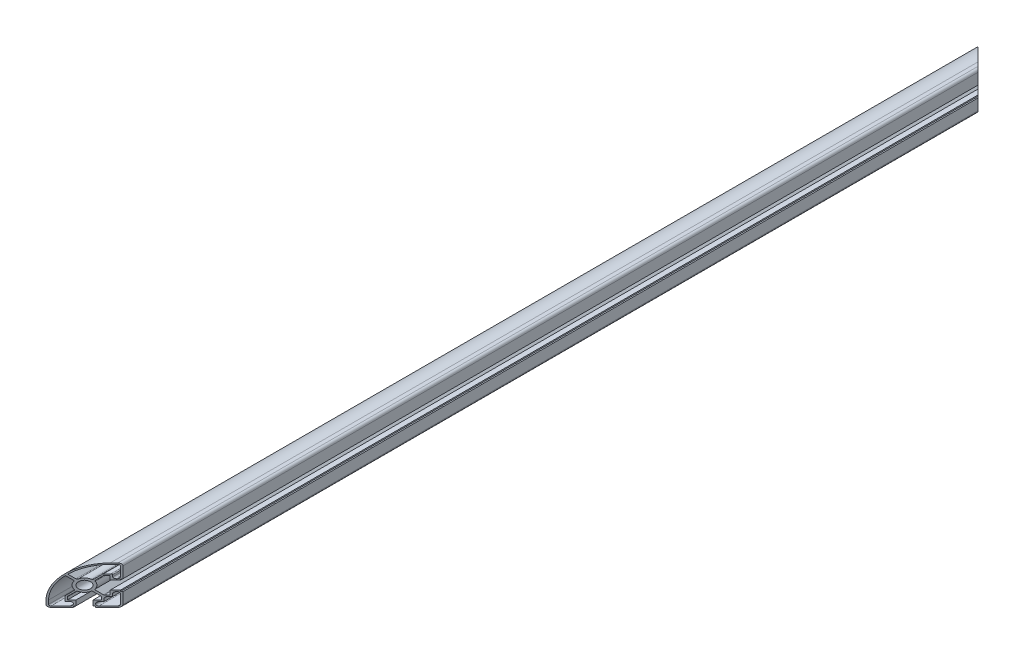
SolidWorks part; units mm, degrees
ref_plane "Ebene vorne" through (0, 0, 0) normal (0, 0, 1) x (1, 0, 0)
ref_plane "Ebene oben" through (0, 0, 0) normal (0, 1, 0) x (1, 0, 0)
ref_plane "Ebene rechts" through (0, 0, 0) normal (1, 0, 0) x (0, 0, -1)
sketch "Skizze1" plane through (0, 0, 0) normal (0, 0, 1) x (1, 0, 0)
  line L0 (-3, 0) -> (-16, 0)
  line L1 (0, 3) -> (0, 16)
  line L2 (-3, 45) -> (-7.5, 45)
  line L3 (-45, 3) -> (-45, 7.5)
  line L4 (-27.5, 1.5) -> (-27.5, 7.5)
  line L5 (-32.5, 7.5) -> (-32.5, 10.6716)
  line L6 (-32.5, 7.5) -> (-27.5, 7.5)
  line L7 (-27.5018, 16.084) -> (-32.2071, 11.3787)
  line L8 (0, 0) -> (-41.2602, 41.2602) construction
  line L9 (-22.5, -8.66) -> (-22.5, 55.2654) construction
  line L10 (-12.5, 7.5) -> (-12.5, 10.6716)
  line L11 (-17.5, 1.5) -> (-17.5, 7.5)
  line L12 (-12.5, 7.5) -> (-17.5, 7.5)
  line L13 (-18.0813, 16.6671) -> (-12.7929, 11.3787)
  line L14 (0.7071, 0.7071) -> (-0.2929, 1.7071)
  line L15 (-0.7071, -0.7071) -> (-1.7071, 0.2929)
  line L16 (0.7071, 0.7071) -> (-40.5531, 41.9673) construction
  line L17 (-0.7071, -0.7071) -> (-41.9673, 40.5531) construction
  line L18 (-28.916, 27.5018) -> (-33.6531, 32.2389)
  line L19 (-27.5018, 28.916) -> (-32.2389, 33.6531)
  line L20 (0, 16) -> (-6, 16) construction
  line L21 (-16.6671, 18.0813) -> (-11.3787, 12.7929)
  line L22 (-7.5, 12.5) -> (-10.6716, 12.5)
  line L23 (-7.5, 12.5) -> (-7.5, 17.5)
  line L24 (-1.5, 17.5) -> (-7.5, 17.5)
  line L25 (-1.5, 27.5) -> (-7.5, 27.5)
  line L26 (-7.5, 32.5) -> (-7.5, 27.5)
  line L27 (-7.5, 32.5) -> (-10.6716, 32.5)
  line L28 (-16.084, 27.5018) -> (-11.3787, 32.2071)
  line L29 (-17.0207, 17.7278) -> (-16.9842, 17.6913)
  line L30 (-11, 6) -> (-11, 9)
  line L31 (-11, 6) -> (-14, 6)
  line L32 (-16, 3.5) -> (-16, 4)
  line L33 (-3.5, 16) -> (-4, 16)
  line L34 (-6, 11) -> (-6, 14)
  line L35 (-6, 11) -> (-9, 11)
  line L36 (-17.7278, 17.0207) -> (-17.6913, 16.9842)
  line L37 (-3, 1.5) -> (-14, 1.5)
  line L38 (-43.5, 3) -> (-43.5, 7.5)
  line L39 (-3, 43.5) -> (-7.5, 43.5)
  line L40 (-1.5, 3) -> (-1.5, 14)
  line L41 (-11, 6) -> (-11, 11.7071) construction
  line L42 (-6, 11) -> (-11.7071, 11) construction
  line L43 (-17.0207, 17.7278) -> (-11, 11.7071) construction
  line L44 (-17.7278, 17.0207) -> (-11.7071, 11) construction
  line L45 (0, 17.5) -> (-7.5, 17.5) construction
  line L46 (-16, 0) -> (-16, 6) construction
  line L47 (-17.5, 0) -> (-17.5, 7.5) construction
  line L48 (-11, 6) -> (-16, 6) construction
  line L49 (-3, 1.5) -> (-42, 1.5) construction
  line L50 (-1.5, 3) -> (-1.5, 42) construction
  line L51 (-6, 11) -> (-6, 16) construction
  line L52 (0, 27.5) -> (-7.5, 27.5) construction
  line L55 (-42, 1.5) -> (-31, 1.5)
  line L56 (-1.5, 42) -> (-1.5, 31)
  line L57 (-3.5, 29) -> (-4, 29)
  line L58 (-6, 33) -> (-6, 31)
  line L59 (-7, 34) -> (-11.2929, 34)
  line L60 (-17.0686, 28.6385) -> (-12, 33.7071)
  line L61 (-28.6385, 17.0686) -> (-34, 11.7071)
  line L62 (-34, 6) -> (-34, 11.7071)
  line L63 (-34, 6) -> (-31, 6)
  line L64 (-29, 3.5) -> (-29, 4)
  line L65 (0, 29) -> (-6, 29) construction
  line L66 (-17.7278, 27.9793) -> (-11.7071, 34) construction
  line L67 (-16.6671, 26.9187) -> (-11.0858, 32.5) construction
  line L68 (-26.9187, 16.6671) -> (-32.5, 11.0858) construction
  line L69 (-27.9793, 17.7278) -> (-34, 11.7071) construction
  line L70 (-29, 1.5) -> (-29, 6) construction
  line L71 (-34, 6) -> (-29, 6) construction
  line L72 (-6, 34) -> (-6, 29) construction
  line L73 (-6, 34) -> (-11.7071, 34) construction
  line L74 (-7.5, 32.5) -> (-11.0858, 32.5) construction
  line L75 (-32.5, 7.5) -> (-32.5, 11.0858) construction
  line L76 (-12.5, 7.5) -> (-12.5, 11.0858) construction
  line L77 (-18.0813, 16.6671) -> (-12.5, 11.0858) construction
  line L78 (-7.5, 12.5) -> (-11.0858, 12.5) construction
  line L79 (-16.6671, 18.0813) -> (-11.0858, 12.5) construction
  line L80 (0, 29) -> (0, 42)
  line L81 (0, 3) -> (0, 42) construction
  line L82 (-29, 0) -> (-42, 0)
  line L83 (-3, 0) -> (-42, 0) construction
  line L84 (-1.5, 17.5) -> (-1.5, 16)
  line L85 (-27.5, 1.5) -> (-29, 1.5)
  line L86 (-1.5, 16) -> (0, 16)
  line L88 (-29, 1.5) -> (-29, 0)
  line L89 (-17.5, 1.5) -> (-16, 1.5)
  line L92 (-16, 1.5) -> (-16, 0)
  line L95 (0, 29) -> (-1.5, 29)
  line L96 (-1.5, 27.5) -> (-1.5, 29)
  arc A0 (-7.5, 45) -> (-45, 7.5) centre (-7.5, 7.5) ccw
  circle A1 centre (-22.5, 22.5) radius 5
  arc A2 (-45, 3) -> (-42, 0) centre (-42, 3) ccw
  arc A3 (0, 42) -> (-3, 45) centre (-3, 42) ccw
  arc A4 (0, 3) -> (-3, 0) centre (-3, 3) cw
  arc A5 (-28.7667, 26.2783) -> (-28.5226, 18.3437) centre (-22.5, 22.5) ccw
  arc A6 (-43.5, 3) -> (-42, 1.5) centre (-42, 3) ccw
  arc A7 (-7.5, 43.5) -> (-32.2389, 33.6531) centre (-7.5, 7.5) ccw
  arc A8 (-1.5, 42) -> (-3, 43.5) centre (-3, 42) ccw
  arc A9 (-1.5, 3) -> (-3, 1.5) centre (-3, 3) cw
  arc A10 (-9, 11) -> (-11, 9) centre (-9, 9) ccw
  arc A11 (-16, 4) -> (-14, 6) centre (-14, 4) cw
  arc A12 (-14, 1.5) -> (-16, 3.5) centre (-14, 3.5) cw
  arc A13 (-1.5, 14) -> (-3.5, 16) centre (-3.5, 14) ccw
  arc A14 (-6, 14) -> (-4, 16) centre (-4, 14) cw
  arc A15 (-33.6531, 32.2389) -> (-43.5, 7.5) centre (-7.5, 7.5) ccw
  arc A16 (-7.5, 43.5) -> (-43.5, 7.5) centre (-7.5, 7.5) ccw construction
  arc A17 (-26.2783, 16.2333) -> (-16.2333, 26.2783) centre (-22.5, 22.5) ccw
  arc A18 (-18.3437, 28.5226) -> (-26.2783, 28.7667) centre (-22.5, 22.5) ccw
  arc A19 (-26.2783, 28.7667) -> (-27.5018, 28.916) centre (-26.7946, 29.6231) cw
  arc A20 (-18.3437, 28.5226) -> (-17.0686, 28.6385) centre (-17.7757, 29.3456) ccw
  arc A21 (-16.2333, 26.2783) -> (-16.084, 27.5018) centre (-15.3769, 26.7946) cw
  arc A22 (-27.5018, 16.084) -> (-26.2783, 16.2333) centre (-26.7946, 15.3769) cw
  arc A23 (-28.5226, 18.3437) -> (-28.6385, 17.0686) centre (-29.3456, 17.7757) cw
  arc A24 (-29, 4) -> (-31, 6) centre (-31, 4) ccw
  arc A25 (-29, 3.5) -> (-31, 1.5) centre (-31, 3.5) cw
  arc A26 (-4, 29) -> (-6, 31) centre (-4, 31) cw
  arc A27 (-3.5, 29) -> (-1.5, 31) centre (-3.5, 31) ccw
  arc A28 (-6, 33) -> (-7, 34) centre (-7, 33) ccw
  arc A29 (-12, 33.7071) -> (-11.2929, 34) centre (-11.2929, 33) cw
  arc A30 (-10.6716, 32.5) -> (-11.3787, 32.2071) centre (-10.6716, 31.5) ccw
  arc A31 (-32.5, 10.6716) -> (-32.2071, 11.3787) centre (-31.5, 10.6716) cw
  arc A32 (-12.5, 10.6716) -> (-12.7929, 11.3787) centre (-13.5, 10.6716) ccw
  arc A33 (-10.6716, 12.5) -> (-11.3787, 12.7929) centre (-10.6716, 13.5) cw
  arc A34 (-28.7667, 26.2783) -> (-28.916, 27.5018) centre (-29.6231, 26.7946) ccw
  point P3 (-7.5, 7.5)
  point P12 (-45, 0)
  point P15 (0, 45)
  point P18 (0, 0)
  point P85 (-11, 11)
  point P118 (-16.6671, 26.9187)
  point P122 (-26.9187, 16.6671)
  point P151 (-12.5, 11.0858)
  point P155 (-11.0858, 12.5)
  dimension "D1" = 7.5
  dimension "D3" = 75
  dimension "D6" = 10
  dimension "D7" = 3
  dimension "D13" = 2
  dimension "D15" = 1
  dimension "D16" = 2
  dimension "D17" = 1
  dimension "D18" = 1
  dimension "GrößeProfil" = 45
  dimension "D2" = 7.5
  dimension "D4" = 22.5
  dimension "D5" = 22.5
  dimension "D8" = 5
  dimension "D9" = 5
  dimension "D10" = 1.5
  dimension "D11" = 1
  dimension "D12" = 1
  dimension "D14" = 1.5
extrude "Linear austragen1" add sketch "Skizze1" along normal up to vertex (645.8515 mm away) from vertex
sketch "Skizze5" plane through (0, 0, 0) normal (0, -1, 0) x (1, 0, 0)
  line L0 (-45, -525.5288) -> (0, -480.5288)
  line L1 (0, 564.4712) -> (0, -525.5288) construction
  line L2 (0, -480.5288) -> (0, -525.5288)
  line L3 (0, -525.5288) -> (-45, -525.5288)
  line L4 (-45, 564.4712) -> (0, 519.4712)
  line L6 (0, 519.4712) -> (0, 564.4712)
  line L7 (0, 564.4712) -> (-45, 564.4712)
  dimension "D1" = 45
  dimension "D2" = 45
extrude "Schnitt-Linear austragen2" cut sketch "Skizze5" against normal blind 74.3573
